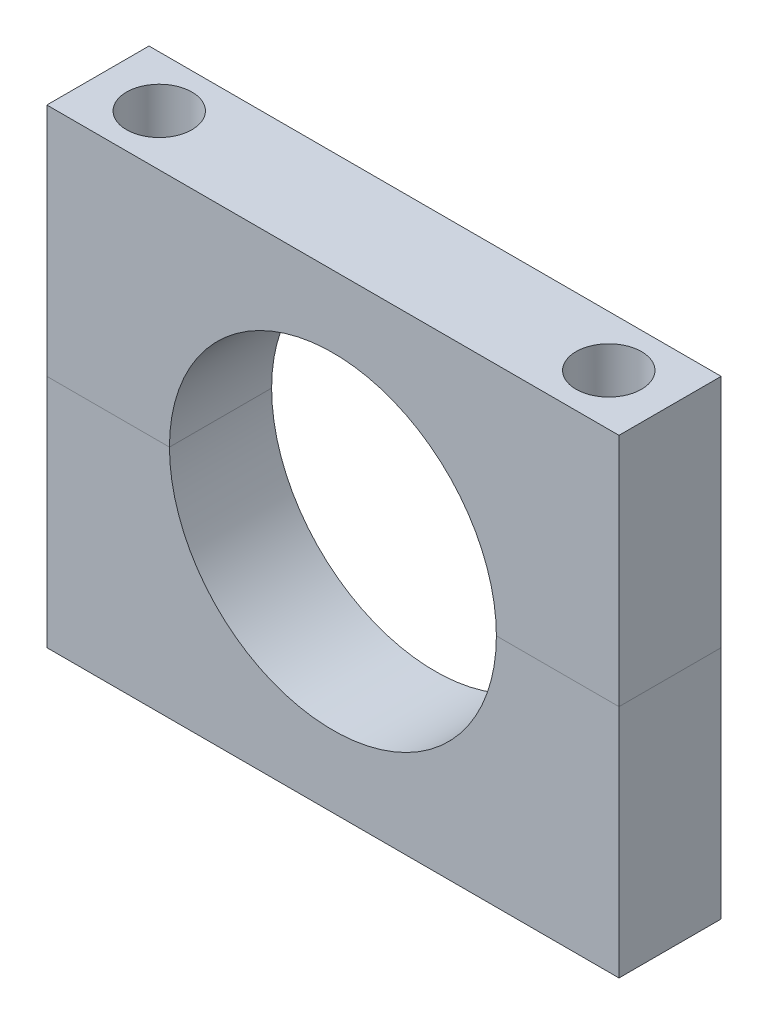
SolidWorks part; units mm, degrees
ref_plane "前视基准面" through (0, 0, 0) normal (0, 0, 1) x (1, 0, 0)
ref_plane "上视基准面" through (0, 0, 0) normal (0, 1, 0) x (1, 0, 0)
ref_plane "右视基准面" through (0, 0, 0) normal (1, 0, 0) x (0, 0, -1)
other "Configuration Table"
sketch "草图1" plane through (0, 0, 0) normal (0, 0, 1) x (1, 0, 0)
  line L1 (-14, -11.5) -> (14, -11.5)
  line L2 (-14, -11.5) -> (-14, 11.5)
  line L3 (-14, 11.5) -> (14, 11.5)
  line L4 (14, -11.5) -> (14, 11.5)
  line L5 (-14, -11.5) -> (14, 11.5) construction
  line L6 (-14, 11.5) -> (14, -11.5) construction
  circle A0 centre (0, 0) radius 8
  point P0 (0, 0)
  dimension "D3" = 16
  dimension "D1" = 28
  dimension "D2" = 23
extrude "凸台-拉伸1" add sketch "草图1" along normal blind 5
sketch "草图2" plane through (0, 11.5, 0) normal (0, 1, 0) x (1, 0, 0)
  line L0 (-14, -2.5) -> (14, -2.5) construction
  line L1 (-14, -5) -> (-14, 0) construction
  line L2 (14, -5) -> (14, 0) construction
  line L3 (0, -5) -> (0, 0) construction
  line L4 (14, -5) -> (-14, -5) construction
  circle A0 centre (-11, -2.5) radius 1.6
  circle A1 centre (11, -2.5) radius 1.6
  dimension "D1" = 3.2
  dimension "D2" = 22
extrude "切除-拉伸1" cut sketch "草图2" against normal through all
split "分割1" trim tools "上视基准面" bodies to split 107 resulting bodies 108 109
